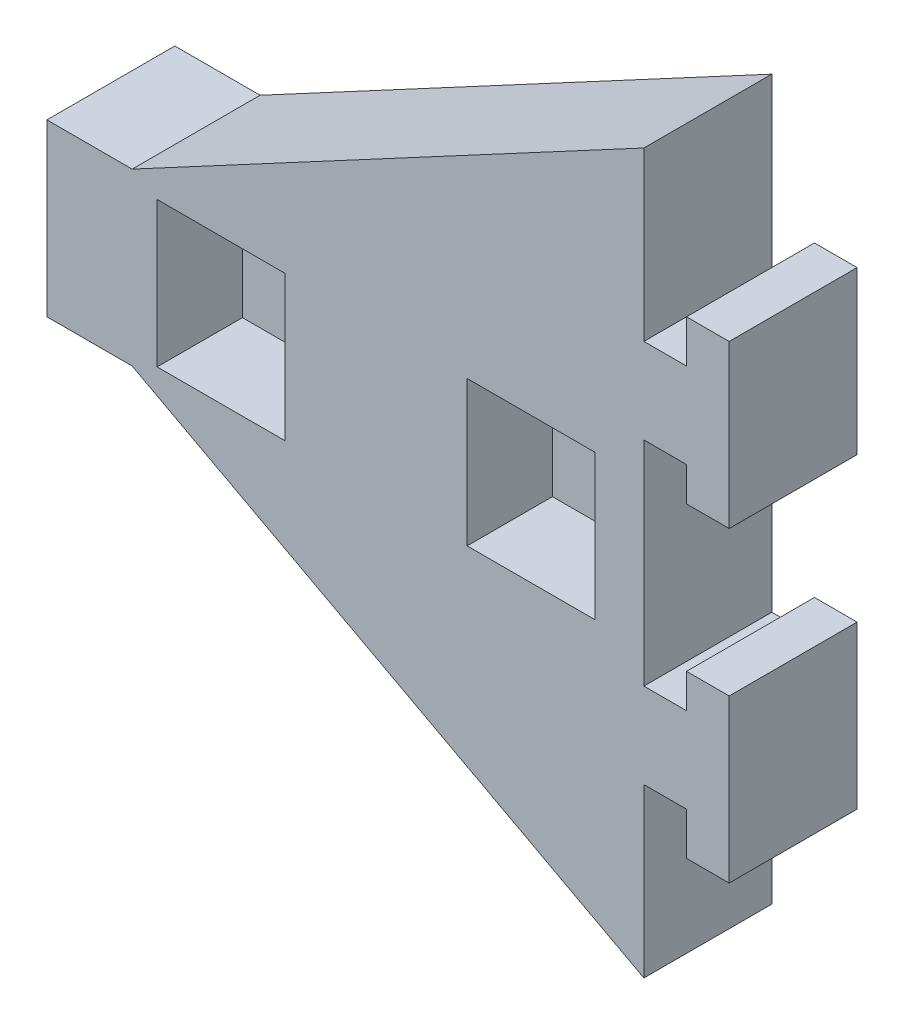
SolidWorks part; units mm, degrees
ref_plane "Front Plane" through (0, 0, 0) normal (0, 0, 1) x (1, 0, 0)
ref_plane "Top Plane" through (0, 0, 0) normal (0, 1, 0) x (1, 0, 0)
ref_plane "Right Plane" through (0, 0, 0) normal (1, 0, 0) x (0, 0, -1)
sketch "Sketch4" plane through (0, 0, 0) normal (0, 0, 1) x (1, 0, 0)
  line L1 (70, 0) -> (70, -95)
  line L2 (70, -95) -> (0, -57.5)
  line L3 (70, 0) -> (70, -47.5) construction
  line L4 (70, 0) -> (0, -37.5)
  line L5 (70, -47.5) -> (70, 0) construction
  line L6 (0, -57.5) -> (-10, -57.5)
  line L7 (0, -37.5) -> (-10, -37.5)
  line L8 (-10, -37.5) -> (-10, -57.5)
  dimension "D1" = 95
  dimension "D2" = 47.5
extrude "Boss-Extrude4" add sketch "Sketch4" along normal blind 15
sketch "Sketch6" plane through (0, 0, 15) normal (0, 0, 1) x (1, 0, 0)
  line L2 (60, -89.6429) -> (60, -70)
  line L6 (65, -60) -> (65, -55)
  line L7 (60, -25) -> (60, -5.3571)
  line L8 (70, -95) -> (70, 0) construction
  line L10 (70, -40) -> (70, -20)
  line L11 (70, 0) -> (0, -37.5) construction
  line L14 (70, -75) -> (65, -75)
  line L15 (65, -75) -> (65, -70)
  line L16 (65, -55) -> (70, -55)
  line L17 (60, -5.3571) -> (59.8503, -4.978)
  line L18 (65, -25) -> (65, -20)
  line L20 (65, -40) -> (70, -40)
  line L21 (70, -20) -> (65, -20)
  line L22 (65, -25) -> (60, -25)
  line L23 (60, -35) -> (65, -35)
  line L24 (70, -55) -> (70.0202, -54.6763)
  line L25 (65, -70) -> (60, -70)
  line L26 (65, -60) -> (60, -60)
  line L27 (60, -60) -> (60, -35)
  line L28 (65, -35) -> (65, -40)
  line L30 (70, -75) -> (70, -55) construction
  line L31 (70, -75) -> (70, -55)
  line L32 (0, -57.5) -> (70, -95) construction
  dimension "D1" = 5
  dimension "D2" = 5
  dimension "D3" = 25
  dimension "D4" = 5
  dimension "D6" = 20
  dimension "D7" = 20
extrude "Cut-Extrude4" cut sketch "Sketch6" against normal blind 15 contours L22 L18 L21 L7 M13 M41 | L15 L25 L2 L14 M43 M13 | L28 L23 L27 L26 L6 L16 L20 M13
sketch "Sketch7" plane through (0, 0, 15) normal (0, 0, 1) x (1, 0, 0)
  line L0 (17.9242, -56.1237) -> (39.2746, -56.1237) construction
  line L1 (54.2746, -39.1237) -> (54.2746, -56.1237)
  line L2 (54.2746, -56.1237) -> (39.2746, -56.1237)
  line L4 (54.2746, -39.1237) -> (39.2746, -39.1237)
  line L6 (2.9242, -47.6237) -> (2.9242, -56.1237)
  line L7 (2.9242, -47.6237) -> (2.9242, -39.1237)
  line L8 (2.9242, -56.1237) -> (17.9242, -56.1237)
  line L9 (2.9242, -39.1237) -> (17.9242, -39.1237)
  line L10 (17.9242, -39.1237) -> (17.9242, -56.1237)
  line L12 (39.2746, -39.1237) -> (39.2746, -56.1237)
  dimension "D1" = 21.3504
extrude "Cut-Extrude5" cut sketch "Sketch7" against normal blind 10
sketch "Croquis1" plane through (0, 0, 15) normal (0, 0, 1) x (1, 0, 0)
  line L0 (65, -55) -> (65, -56)
  line L1 (65, -60) -> (65, -55) construction
  line L2 (65, -55) -> (70, -55)
  line L3 (70, -55) -> (70, -56)
  line L4 (70, -75) -> (70, -55) construction
  line L5 (70, -56) -> (65, -56)
  line L6 (65, -40) -> (70, -40)
  line L7 (70, -40) -> (70, -20) construction
  line L8 (65, -40) -> (70, -40) construction
  line L9 (70, -40) -> (70, -39)
  line L10 (70, -39) -> (65, -39)
  line L11 (65, -35) -> (65, -40) construction
  line L12 (65, -39) -> (65, -40)
extrude "Cortar-Extruir1" cut sketch "Croquis1" against normal blind 15
